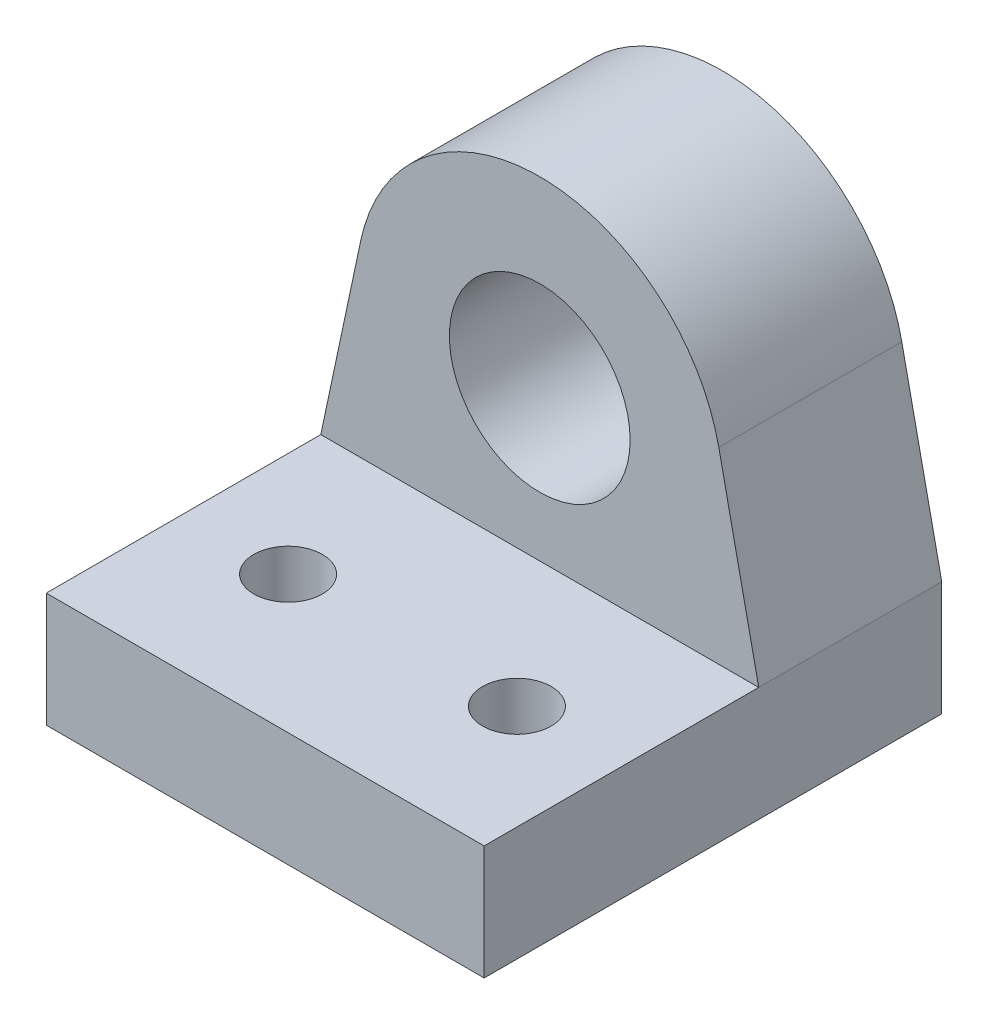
SolidWorks part; units mm, degrees
ref_plane "前视基准面" through (0, 0, 0) normal (0, 0, 1) x (1, 0, 0)
ref_plane "上视基准面" through (0, 0, 0) normal (0, 1, 0) x (1, 0, 0)
ref_plane "右视基准面" through (0, 0, 0) normal (1, 0, 0) x (0, 0, -1)
sketch "草图1" plane through (0, 0, 0) normal (0, 0, 1) x (1, 0, 0)
  line L0 (0, 0) -> (0, -6.55) construction
  line L1 (9.5704, -6.55) -> (-9.5704, -6.55)
  line L2 (-9.5704, -6.55) -> (-7.8253, 1.6628)
  line L3 (9.5704, -6.55) -> (7.8253, 1.6628)
  circle A0 centre (0, 0) radius 3.95
  arc A1 (7.8253, 1.6628) -> (-7.8253, 1.6628) centre (0, 0) ccw
  dimension "D1" = 16
  dimension "D2" = 7.9
  dimension "D3" = 6.55
extrude "凸台-拉伸1" add sketch "草图1" along normal blind 8
sketch "草图3" plane through (0, -6.55, 0) normal (0, -1, 0) x (1, 0, 0)
  line L0 (9.5704, 8) -> (9.5704, 0) construction
  line L1 (-9.5704, 0) -> (9.5704, 0)
  line L2 (-9.5704, 0) -> (-9.5704, 20)
  line L3 (-9.5704, 20) -> (9.5704, 20)
  line L4 (9.5704, 0) -> (9.5704, 20)
  dimension "D1" = 20
extrude "凸台-拉伸2" add sketch "草图3" along normal blind 5
sketch "草图4" plane through (0, -6.55, 0) normal (0, 1, 0) x (1, 0, 0)
  line L0 (0, -20) -> (0, -8) construction
  line L1 (9.5704, -20) -> (-9.5704, -20) construction
  line L2 (-7.8253, -8) -> (7.8253, -8) construction
  circle A0 centre (-5, -14) radius 1.5
  circle A1 centre (5, -14) radius 1.5
  dimension "D1" = 5
extrude "切除-拉伸1" cut sketch "草图4" against normal blind 8
sketch "草图6" plane through (0, 0, 0) normal (0, 0, -1) x (-1, 0, 0)
  line L0 (7.3362, -3.1906) -> (8.3576, -0.8422)
  line L1 (8.3576, -0.8422) -> (9.5704, -6.55)
  line L2 (9.5704, -6.55) -> (9.5704, -11.55)
  line L3 (9.5704, -11.55) -> (0, -11.55)
  line L4 (9.5704, -11.55) -> (-9.5704, -11.55) construction
  line L5 (0, -11.55) -> (0, -8)
  line L6 (7.8253, 1.6628) -> (9.5704, -6.55) construction
  arc A0 (0, -8) -> (7.3362, -3.1906) centre (0, 0) ccw
  point P1 (8.1786, 0)
  dimension "D1" = 16
extrude "凸台-拉伸3" add sketch "草图6" along normal blind 3
